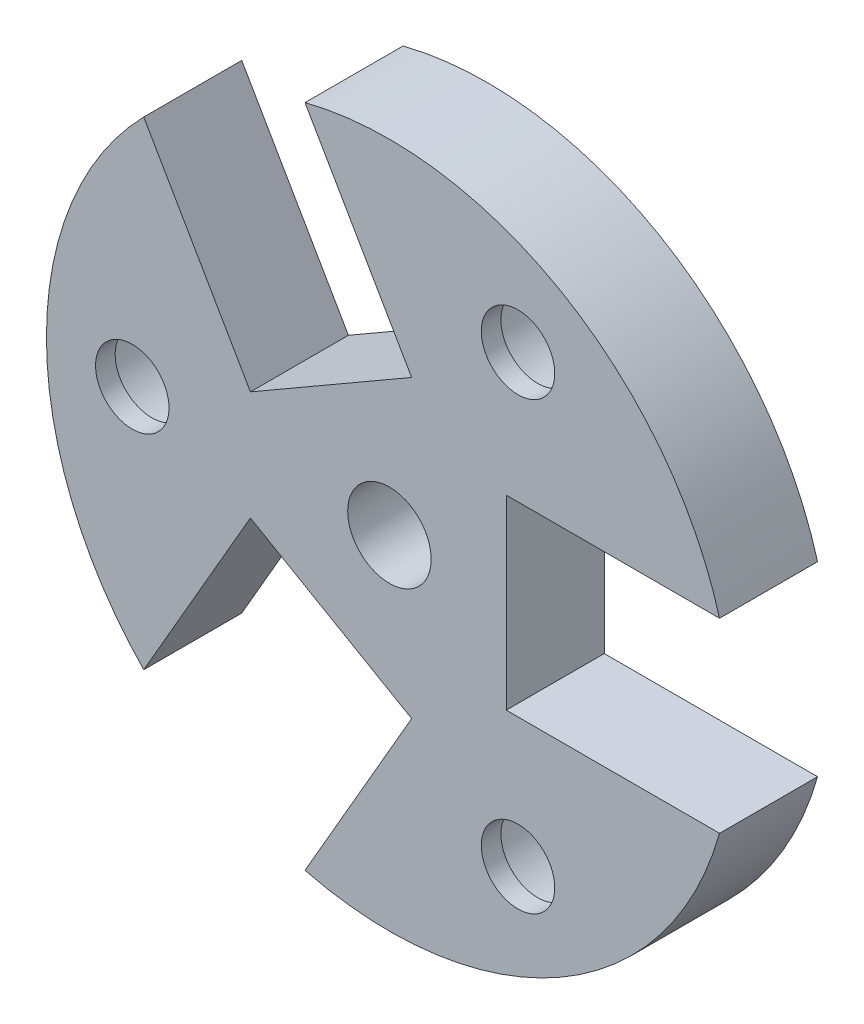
SolidWorks part; units mm, degrees
ref_plane "Front Plane" through (0, 0, 0) normal (0, 0, 1) x (1, 0, 0)
ref_plane "Top Plane" through (0, 0, 0) normal (0, 1, 0) x (1, 0, 0)
ref_plane "Right Plane" through (0, 0, 0) normal (1, 0, 0) x (0, 0, -1)
sketch "Sketch2" plane through (0, 0, 0) normal (0, 0, 1) x (1, 0, 0)
  circle A0 centre (0, 0) radius 22.225
  dimension "D1" = 44.45
extrude "Extrude1" add sketch "Sketch2" against normal blind 6.35
sketch "Sketch3" plane through (0, 0, 0) normal (0, 0, 1) x (1, 0, 0)
  circle A0 centre (0, 0) radius 16.5989
  dimension "D1" = 33.1978
sketch "Sketch6" plane through (0, 0, 0) normal (0, 0, 1) x (1, 0, 0)
  line L1 (7.5692, 6.0325) -> (32.9692, 6.0325)
  line L2 (7.5692, 6.0325) -> (7.5692, -6.0325)
  line L3 (7.5692, -6.0325) -> (32.9692, -6.0325)
  line L4 (32.9692, 6.0325) -> (32.9692, -6.0325)
  dimension "D1" = 7.5692
  dimension "D2" = 25.4
  dimension "D3" = 12.065
  dimension "D4" = 6.0325
extrude "Cut-Extrude2" cut sketch "Sketch6" against normal through all
pattern_circular "CirPattern1" count 3 over 360 about axis through (0, 0, 0) along (0, 0, 1) of "Cut-Extrude2"
sketch "Sketch8" plane through (0, 0, -6.35) normal (0, 0, -1) x (-1, 0, 0)
  line L0 (0, 0) -> (36.2362, 0) construction
  circle A0 centre (16.6624, 0) radius 2.3813
  dimension "D1" = 4.7625
  dimension "D2" = 16.6624
extrude "Cut-Extrude3" cut sketch "Sketch8" against normal through all
sketch "Sketch10" plane through (0, 0, -6.35) normal (0, 0, -1) x (-1, 0, 0)
  circle A0 centre (16.6624, 0) radius 3.9688
  dimension "D1" = 7.9375
extrude "Cut-Extrude4" cut sketch "Sketch10" against normal blind 5.08
pattern_circular "CirPattern2" count 3 over 360 about axis through (0, 0, 0) along (0, 0, 1) of "Cut-Extrude4", "Cut-Extrude3"
hole_wizard "1/4-28 Tapped Hole1" positions "Sketch12" profile "Sketch11" tap size "1/4-28" standard "Ansi Inch"
sketch "Sketch12" plane through (0, 0, -6.35) normal (0, 0, -1) x (-1, 0, 0)
  point P1 (0, 0)
sketch "Sketch11" plane through (0, 0, -6.35) normal (1, 0, 0) x (0, 1, 0)
  line L0 (0, 0) -> (0, 6.35)
  line L1 (0, 6.35) -> (2.7051, 6.35)
  line L2 (2.7051, 6.35) -> (2.7051, 0)
  line L5 (2.7051, 0) -> (0, 0)
  line L11 (0, -6.35) -> (0, 107.95) construction
  dimension "Thru Tap Drill Dia." = 5.4102
  dimension "Thru Tap Drill Depth" = 6.35
